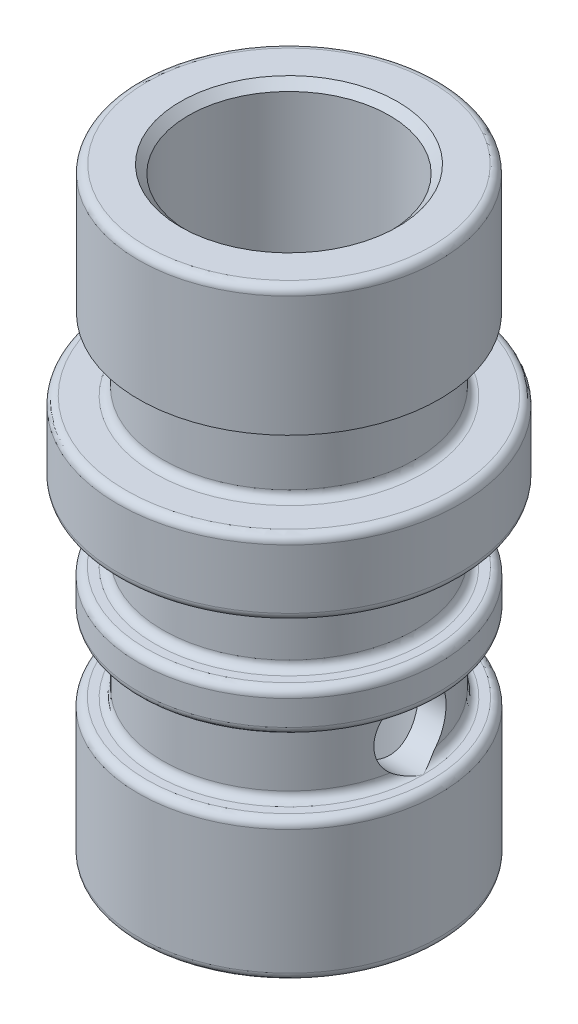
SolidWorks part; units mm, degrees
ref_plane "Front Plane" through (0, 0, 0) normal (0, 0, 1) x (1, 0, 0)
ref_plane "Top Plane" through (0, 0, 0) normal (0, 1, 0) x (1, 0, 0)
ref_plane "Right Plane" through (0, 0, 0) normal (1, 0, 0) x (0, 0, -1)
sketch "Sketch1" plane through (0, 0, 0) normal (0, 0, 1) x (1, 0, 0)
  line L0 (9.5313, 0) -> (9.5313, 8.89)
  line L1 (9.5313, 8.89) -> (7.9883, 8.89)
  line L2 (7.9883, 8.89) -> (7.9883, 13.462)
  line L3 (7.9883, 13.462) -> (9.5313, 13.462)
  line L4 (9.5313, 13.462) -> (9.5313, 16.0655)
  line L5 (9.5313, 16.0655) -> (7.9883, 16.0655)
  line L6 (7.9883, 16.0655) -> (7.9883, 20.6375)
  line L7 (7.9883, 20.6375) -> (10.8331, 20.6375)
  line L8 (10.8331, 20.6375) -> (10.8331, 25.4)
  line L9 (10.8331, 25.4) -> (7.9883, 25.4)
  line L10 (7.9883, 25.4) -> (7.9883, 29.972)
  line L11 (7.9883, 29.972) -> (9.5123, 29.972)
  line L12 (9.5123, 29.972) -> (9.5123, 38.1)
  line L13 (9.5123, 38.1) -> (0, 38.1)
  line L14 (0, 0) -> (0, 57.6032) construction
  line L15 (9.5313, 0) -> (0, 0)
  line L16 (0, 38.1) -> (0, 0)
  line L17 (7.9883, 11.176) -> (28.5115, 11.176) construction
  dimension "D1" = 38.1
  dimension "D2" = 4.7625
  dimension "D3" = 9.5123
  dimension "D4" = 10.8331
  dimension "D5" = 9.5313
  dimension "D6" = 25.4
  dimension "D7" = 4.572
  dimension "D8" = 1.524
  dimension "D9" = 14.224
revolve "Revolve1" add sketch "Sketch1" angle 360 about L14
sketch "Sketch2" plane through (0, 38.1, 0) normal (0, 1, 0) x (1, 0, 0)
  circle A0 centre (0, 0) radius 6.3627
  dimension "D1" = 12.7254
extrude "Extrude1" cut sketch "Sketch2" against normal through all
chamfer "Chamfer1" distance 0.508 distance2 0.508 1 edges at (0, 38.1, 6.3627)
fillet "Fillet1" radius 0.508 14 edges at (0, 38.1, -9.5123) (0, 29.972, -7.9883) (0, 25.4, -7.9883) (0, 25.4, -10.8331) (0, 20.6375, -10.8331) (0, 20.6375, -7.9883) (0, 16.0655, -7.9883) (0, 16.0655, -9.5313) (0, 13.462, -9.5313) (0, 13.462, -7.9883) (0, 8.89, -7.9883) (0, 8.89, -9.5313) (0, 0, -9.5313) (0, 0, 6.3627)
sketch "Sketch3" plane through (0, 0, 0) normal (1, 0, 0) x (0, 0, -1)
  line L0 (10.8331, 25.4) -> (-10.8331, 25.4) construction
  circle A0 centre (0, 11.176) radius 2.286
  dimension "D2" = 4.572
  dimension "D1" = 14.224
extrude "Extrude2" cut sketch "Sketch3" against normal through all and the other way through all
